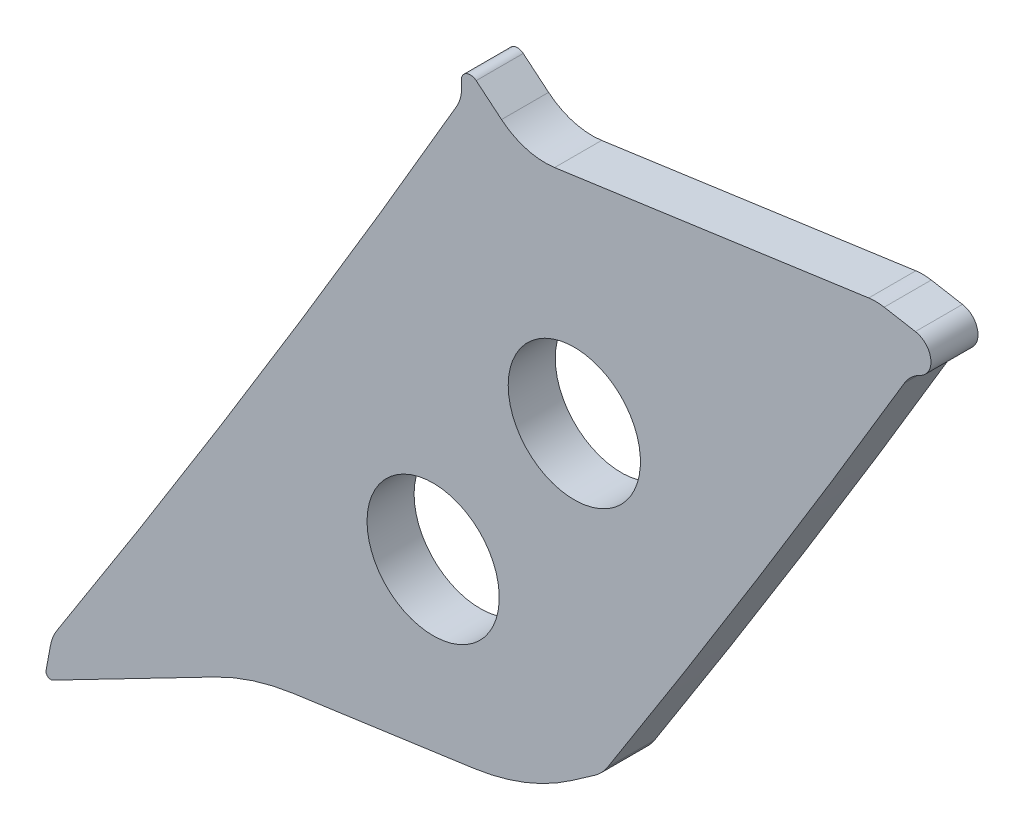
SolidWorks part; units mm, degrees
ref_plane "Front" through (0, 0, 0) normal (0, 0, 1) x (1, 0, 0)
ref_plane "Top" through (0, 0, 0) normal (0, 1, 0) x (1, 0, 0)
ref_plane "Right" through (0, 0, 0) normal (1, 0, 0) x (0, 0, -1)
sketch "Sketch1" plane through (0, 0, 0) normal (0, 0, 1) x (1, 0, 0)
  line L14 (-932.5215, 21.1817) -> (-932.7538, 19.9234)
  line L15 (-932.3874, 19.6516) -> (-923.6373, 24.1731)
  line L16 (-919.4122, 25.5185) -> (-909.6588, 26.8893)
  line L17 (-904.3888, 28.9572) -> (-903.1381, 29.8281)
  line L18 (-885.8289, 59.2254) -> (-887.5136, 59.5225)
  line L19 (-888.3479, 59.537) -> (-905.3042, 57.154)
  line L20 (-908.1685, 57.9667) -> (-909.5368, 59.1021)
  line L21 (-932.5215, 21.1817) -> (-932.7538, 19.9234)
  line L22 (-932.3874, 19.6516) -> (-923.6373, 24.1731)
  line L23 (-919.4122, 25.5185) -> (-909.6588, 26.8893)
  line L24 (-904.3888, 28.9572) -> (-903.1381, 29.8281)
  line L25 (-885.8289, 59.2254) -> (-887.5136, 59.5225)
  line L26 (-888.3479, 59.537) -> (-905.3042, 57.154)
  line L27 (-908.1685, 57.9667) -> (-909.5368, 59.1021)
  arc A26 (-932.1583, 22.0973) -> (-932.5215, 21.1817) centre (-930.0237, 20.7206) ccw
  arc A27 (-932.7538, 19.9234) -> (-932.3874, 19.6516) centre (-932.504, 19.8773) ccw
  arc A28 (-919.4122, 25.5185) -> (-923.6373, 24.1731) centre (-917.574, 12.4391) ccw
  arc A29 (-909.6588, 26.8893) -> (-904.3888, 28.9572) centre (-911.3556, 38.9626) ccw
  arc A30 (-903.1381, 29.8281) -> (-902.4523, 30.54) centre (-904.5895, 31.9125) ccw
  arc A31 (-902.4523, 30.54) -> (-886.4242, 56.5177) centre (-1614.1655, 487.596) ccw
  arc A32 (-885.5622, 57.3106) -> (-886.4242, 56.5177) centre (-884.6759, 55.4821) ccw
  arc A33 (-885.5622, 57.3106) -> (-885.8289, 59.2254) centre (-886.0054, 58.2249) ccw
  arc A34 (-887.5136, 59.5225) -> (-888.3479, 59.537) centre (-887.9768, 56.896) ccw
  arc A35 (-908.1685, 57.9667) -> (-905.3042, 57.154) centre (-905.8168, 60.8012) ccw
  arc A36 (-909.5368, 59.1021) -> (-910.3386, 58.6578) centre (-909.851, 58.7234) ccw
  arc A37 (-910.5938, 57.3689) -> (-910.3386, 58.6578) centre (-912.3524, 58.3868) ccw
  arc A38 (-932.1583, 22.0973) -> (-910.5938, 57.3689) centre (-1653.9165, 487.596) ccw
  arc A39 (-932.1583, 22.0973) -> (-932.5215, 21.1817) centre (-930.0237, 20.7206) ccw
  arc A40 (-932.7538, 19.9234) -> (-932.3874, 19.6516) centre (-932.504, 19.8773) ccw
  arc A41 (-919.4122, 25.5185) -> (-923.6373, 24.1731) centre (-917.574, 12.4391) ccw
  arc A42 (-909.6588, 26.8893) -> (-904.3888, 28.9572) centre (-911.3556, 38.9626) ccw
  arc A43 (-903.1381, 29.8281) -> (-902.4523, 30.54) centre (-904.5895, 31.9125) ccw
  arc A44 (-902.4523, 30.54) -> (-886.4242, 56.5177) centre (-1614.1655, 487.596) ccw
  arc A45 (-885.5622, 57.3106) -> (-886.4242, 56.5177) centre (-884.6759, 55.4821) ccw
  arc A46 (-885.5622, 57.3106) -> (-885.8289, 59.2254) centre (-886.0054, 58.2249) ccw
  arc A47 (-887.5136, 59.5225) -> (-888.3479, 59.537) centre (-887.9768, 56.896) ccw
  arc A48 (-908.1685, 57.9667) -> (-905.3042, 57.154) centre (-905.8168, 60.8012) ccw
  arc A49 (-909.5368, 59.1021) -> (-910.3386, 58.6578) centre (-909.851, 58.7234) ccw
  arc A50 (-910.5938, 57.3689) -> (-910.3386, 58.6578) centre (-912.3524, 58.3868) ccw
  arc A51 (-932.1583, 22.0973) -> (-910.5938, 57.3689) centre (-1653.9165, 487.596) ccw
  dimension "D1" = 0.508
extrude "Boss-Extrude1" add sketch "Sketch1" against normal blind 2.54 separate body
hole_wizard "Hole1" positions "Point_Sketch" profile "Profil_Sketch" hole size "Ø0.15" standard "ISO"
sketch "Point_Sketch" plane through (-900.5857, 56.3211, -2.54) normal (0, 0, 1) x (-1, 0, 0)
  point P0 (3.6543, 10.6011)
  point P2 (11.2743, 20.7611)
sketch "Profil_Sketch" plane through (-904.24, 45.72, -2.54) normal (1, 0, 0) x (0, 1, 0)
  line L0 (0, 0) -> (0, 2.54)
  line L1 (0, 2.54) -> (3.5687, 2.54)
  line L2 (3.5687, 2.54) -> (3.5687, 0)
  line L5 (3.5687, 0) -> (0, 0)
  line L11 (0, -6.35) -> (0, 107.95) construction
  dimension "Diameter" = 7.1374
  dimension "Thru Hole Depth" = 2.54
other "usin_DL090_.25-20x3-SHCS<1>"
